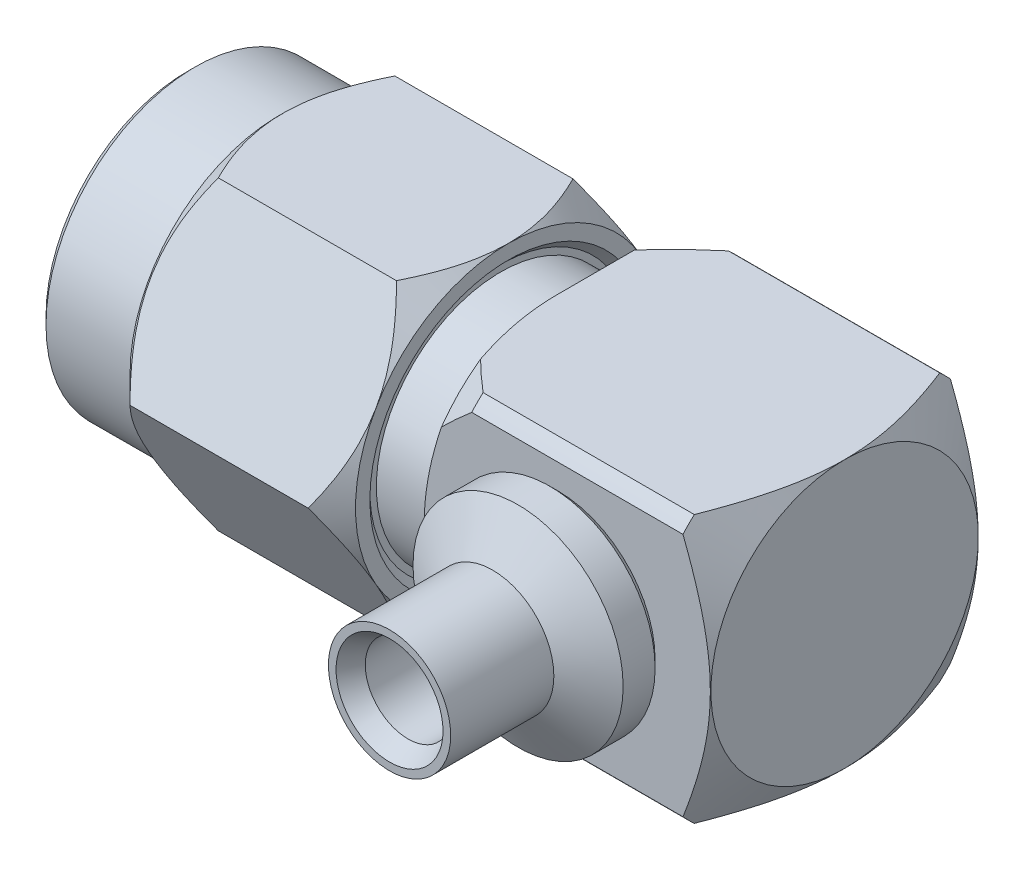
SolidWorks part; units mm, degrees
ref_plane "Front Plane" through (0, 0, 0) normal (0, 0, 1) x (1, 0, 0)
ref_plane "Top Plane" through (0, 0, 0) normal (0, 1, 0) x (1, 0, 0)
ref_plane "Right Plane" through (0, 0, 0) normal (1, 0, 0) x (0, 0, -1)
imported_body "Imported3"
sketch "Sketch1" plane through (12.95, 0, 0) normal (1, 0, 0) x (0, 0, -1)
  line L0 (3.4905, 3.2216) -> (3.4905, -3.2216)
  line L1 (3.2113, -3.5) -> (-3.2113, -3.5)
  line L2 (-3.5095, -3.2009) -> (-3.5095, 3.2009)
  line L3 (-3.2113, 3.5) -> (3.2113, 3.5)
  arc A0 (3.4905, -3.2216) -> (3.2113, -3.5) centre (0, 0) cw
  arc A1 (-3.2113, -3.5) -> (-3.5095, -3.2009) centre (0, 0) cw
  arc A2 (-3.5095, 3.2009) -> (-3.2113, 3.5) centre (0, 0) cw
  arc A3 (3.2113, 3.5) -> (3.4905, 3.2216) centre (0, 0) cw
extrude "Boss-Extrude1" add sketch "Sketch1" along normal blind 1.45
ref_plane "Plane1" through (0, 0, 0) normal (0, 0, -1) x (-1, 0, 0)
sketch "Sketch2" plane through (0, 0, 0) normal (0, 0, -1) x (-1, 0, 0)
  line L0 (1.575, 2.8) -> (1.575, 0)
  line L1 (1.575, 0) -> (2.8, 0)
  line L2 (2.8, 0) -> (2.8, 3.325)
  line L3 (2.8, 3.325) -> (2.1, 3.325)
  line L4 (2.1, 3.325) -> (1.575, 2.8)
  line L5 (1.575, 0) -> (2.8, 0) construction
revolve "Cut-Revolve1" cut sketch "Sketch2" angle 360 about L5
sketch "Sketch3" plane through (0, 0, 0) normal (0, 0, -1) x (-1, 0, 0)
  line L0 (0, 0.46) -> (0, 0)
  line L1 (0, 0) -> (2.2, 0)
  line L2 (2.2, 0) -> (2.2, 0.15)
  line L3 (2.2, 0.15) -> (1.6631, 0.46)
  line L4 (1.6631, 0.46) -> (0, 0.46)
  line L5 (0, 0) -> (2.2, 0) construction
revolve "Revolve1" add sketch "Sketch3" angle 360 about L5
chamfer "Chamfer1" distance 1.25 angle 30 9 edges at (6.9, 3.3637, -3.3538) (6.9, -3.3637, -3.3538) (14.4, 3.3637, -3.3538) (14.4, 3.5, 0) (14.4, 3.3538, 3.3637) (14.4, 0, 3.5095) (14.4, -3.3538, 3.3637) (14.4, -3.5, 0) (14.4, -3.3637, -3.3538)
chamfer "Chamfer2" distance 1.25 angle 30 3 edges at (6.9, -3.3538, 3.3637) (6.9, 0, 3.5095) (6.9, 3.3538, 3.3637)
chamfer "Chamfer3" distance 0.2 angle 45 2 edges at (-2.8, 0, 3.325) (-2.8, 0, 3.9)
